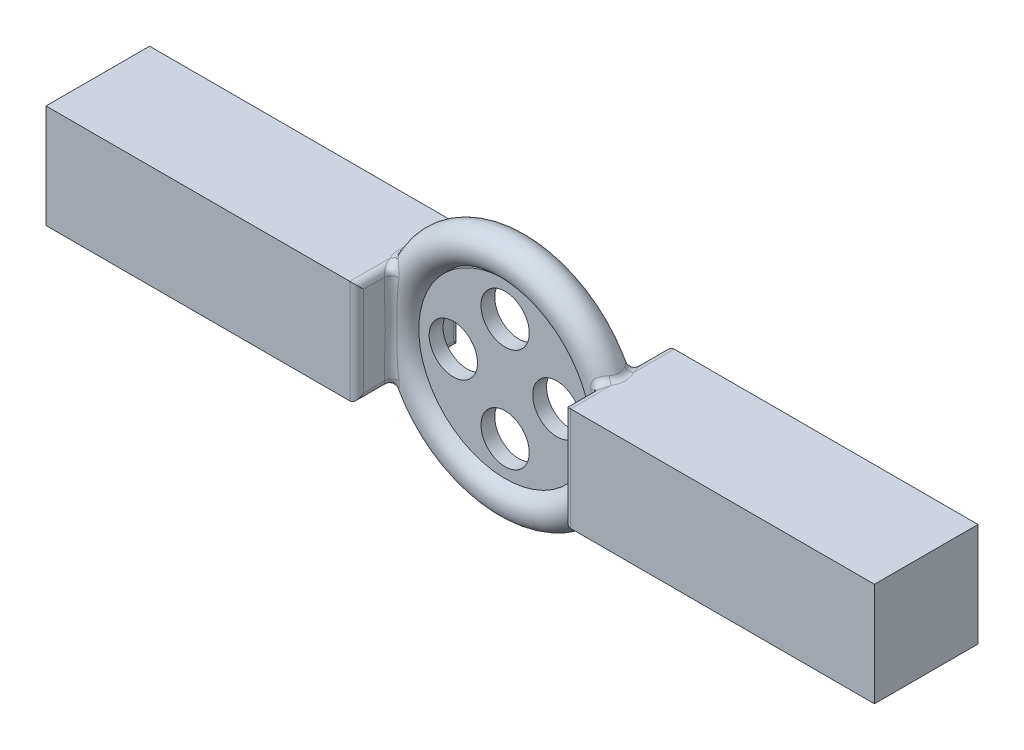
SolidWorks part; units mm, degrees
ref_plane "Front Plane" through (0, 0, 0) normal (0, 0, 1) x (1, 0, 0)
ref_plane "Top Plane" through (0, 0, 0) normal (0, 1, 0) x (1, 0, 0)
ref_plane "Right Plane" through (0, 0, 0) normal (1, 0, 0) x (0, 0, -1)
sketch "Sketch1" plane through (0, 0, 0) normal (0, 1, 0) x (1, 0, 0)
  line L0 (0, -210.8616) -> (0, 210.8616) construction
  circle A0 centre (-150, 0) radius 25
  point P4 (0, 0)
  dimension "D1" = 150
  dimension "D2" = 50
revolve "Revolve1" add sketch "Sketch1" angle 360 about L0
ref_plane "Plane1" through (150, 0, 0) normal (1, 0, 0) x (0, 0, -1)
sketch "Sketch4" plane through (150, 0, 0) normal (1, 0, 0) x (0, 0, -1)
  line L1 (-75, -75) -> (75, -75)
  line L2 (-75, -75) -> (-75, 75)
  line L3 (-75, 75) -> (75, 75)
  line L4 (75, -75) -> (75, 75)
  line L5 (-75, -75) -> (75, 75) construction
  line L6 (-75, 75) -> (75, -75) construction
  point P0 (0, 0)
  dimension "D1" = 150
  dimension "D2" = 150
extrude "Boss-Extrude2" add sketch "Sketch4" along normal blind 450
ref_plane "Plane2" through (-150, 0, 0) normal (1, 0, 0) x (0, 0, -1)
sketch "Sketch5" plane through (-150, 0, 0) normal (1, 0, 0) x (0, 0, -1)
  line L1 (75, -75) -> (-75, -75)
  line L2 (75, -75) -> (75, 75)
  line L3 (75, 75) -> (-75, 75)
  line L4 (-75, -75) -> (-75, 75)
  line L5 (75, -75) -> (-75, 75) construction
  line L6 (75, 75) -> (-75, -75) construction
  point P0 (0, 0)
extrude "Boss-Extrude3" add sketch "Sketch5" against normal blind 450
fillet "Fillet1" radius 10 20 edges at (157.7876, -75, 3.8276) (100.1228, 75, -2.2145) (-100.0233, -75, -0.9658) (-100.1228, 75, -2.2145) (150, 75, 46.3251) (150, 0, 75) (150, -75, 46.3251) (150, 44.4653, 24.1531) (150, -45.2103, -24.0951) (150, -75, -46.3251) (150, 0, -75) (150, 75, -46.3251) (-150, 75, -46.3251) (-150, 0, -75) (-150, -75, -46.3251) (-150, 44.4653, -24.1531) (-150, -45.2103, 24.0951) (-150, -75, 46.3251) (-150, 0, 75) (-150, 75, 46.3251)
sketch "Sketch6" plane through (0, 0, 0) normal (0, 0, 1) x (1, 0, 0)
  circle A0 centre (0, 0) radius 125
extrude "Boss-Extrude4" add sketch "Sketch6" along normal mid plane 20 separate body
sketch "Sketch7" plane through (0, 0, 10) normal (0, 0, 1) x (1, 0, 0)
  circle A0 centre (0, 0) radius 75
  circle A1 centre (0, 75) radius 35
  circle A2 centre (75, 0) radius 35
  circle A3 centre (0, -75) radius 35
  circle A4 centre (-75, 0) radius 35
  dimension "D1" = 70
  dimension "D2" = 4
extrude "Cut-Extrude1" cut sketch "Sketch7" against normal through all contours A4 | A2 | A3 | A1
